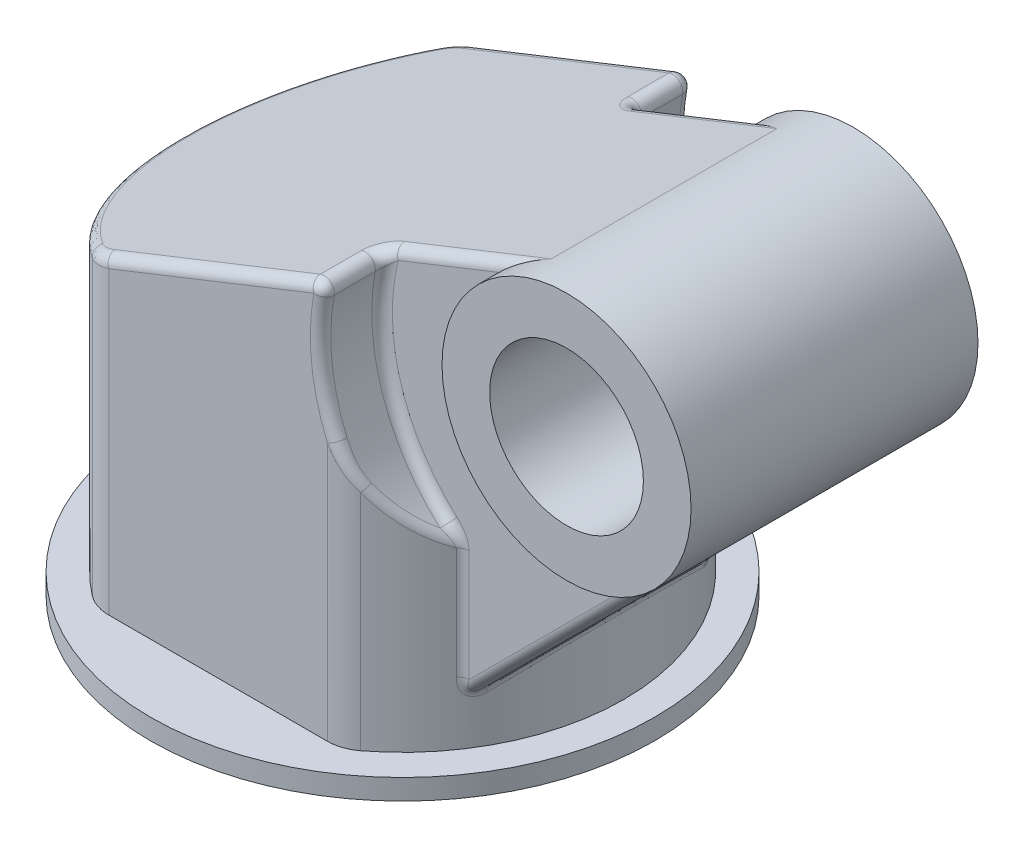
SolidWorks part; units mm, degrees
ref_plane "Front Plane" through (0, 0, 0) normal (0, 0, 1) x (1, 0, 0)
ref_plane "Top Plane" through (0, 0, 0) normal (0, 1, 0) x (1, 0, 0)
ref_plane "Right Plane" through (0, 0, 0) normal (1, 0, 0) x (0, 0, -1)
sketch "Sketch1" plane through (0, 0, 0) normal (0, 1, 0) x (1, 0, 0)
  circle A0 centre (0, 0) radius 123
  dimension "D1" = 246
extrude "Base" add sketch "Sketch1" along normal blind 10
sketch "Sketch2" plane through (0, 10, 0) normal (0, 1, 0) x (-1, 0, 0)
  line L0 (59.6992, -90) -> (-59.6992, -90)
  line L1 (0, 0) -> (84.2309, 0) construction
  line L2 (59.6992, 90) -> (-59.6992, 90)
  arc A1 (59.6992, -90) -> (59.6992, 90) centre (0, 0) ccw
  arc A2 (-59.6992, -90) -> (-59.6992, 90) centre (0, 0) cw
  circle A3 centre (0, 0) radius 123 construction
  dimension "D2" = 15
  dimension "D1" = 180
extrude "Boss-Extrude1" add sketch "Sketch2" along normal blind 196.649
sketch "Sketch6" plane through (0, 0, 0) normal (0, -1, 0) x (1, 0, 0)
  circle A0 centre (0, 0) radius 104.5
  dimension "D1" = 209
extrude "Boss-Extrude3" add sketch "Sketch6" along normal blind 3
sketch "Sketch3" plane through (0, 0, 0) normal (0, 0, 1) x (1, 0, 0)
  line L0 (-59.6992, 206.649) -> (59.6992, 206.649) construction
  line L1 (60, 206.649) -> (-108, 140)
  line L2 (123, 10) -> (-123, 10) construction
  line L3 (60, 206.649) -> (108, 100)
  line L5 (-108, 214.649) -> (-108, 140)
  line L6 (-108, 214.649) -> (108, 214.649)
  line L7 (108, 100) -> (108, 214.649)
  line L9 (-59.6992, 206.649) -> (-108, 206.649) construction
  line L10 (108, 10) -> (108, 206.649) construction
  line L11 (-108, 206.649) -> (-108, 10) construction
  point P0 (60, 206.649)
  dimension "D1" = 90
  dimension "D2" = 130
  dimension "D3" = 60
  dimension "D4" = 8
extrude "Cut-Extrude1" cut sketch "Sketch3" against normal through all and the other way through all
sketch "Sketch5" plane through (0, 0, 0) normal (0, 0, 1) x (1, 0, 0)
  line L0 (-104.5, -3) -> (104.5, -3) construction
  line L1 (78.4268, 19.5162) -> (4.1714, 184.5007)
  line L2 (4.1714, 184.5007) -> (127.5985, 233.4667)
  line L3 (78.4268, 19.5162) -> (192.9553, 134.0447)
  line L4 (-123, 0) -> (123, 0) construction
  line L5 (59.6992, 206.5297) -> (-59.6992, 159.1619) construction
  line L6 (83.8391, 153.6819) -> (60, 206.649) construction
  arc A0 (192.9553, 134.0447) -> (127.5985, 233.4667) centre (150, 177) ccw
  dimension "D1" = 180
  dimension "D2" = 150
  dimension "D4" = 45
  dimension "D6" = 60
extrude "Boss-Extrude2" add sketch "Sketch5" along normal mid plane 120
sketch "Sketch9" plane through (0, 0, 60) normal (0, 0, 1) x (1, 0, 0)
  circle A0 centre (150, 177) radius 100
  dimension "D1" = 200
extrude "Cut-Extrude2" cut sketch "Sketch9" along normal through all
sketch "Sketch7" plane through (0, 0, 0) normal (0, 0, 1) x (1, 0, 0)
  circle A0 centre (150, 177) radius 60.748
  arc A1 (192.9553, 134.0447) -> (127.5985, 233.4667) centre (150, 177) ccw construction
extrude "Boss-Extrude4" add sketch "Sketch7" along normal blind 70
mirror "Mirror1" about plane through (0, 0, 0) normal (0, 0, 1) of "Boss-Extrude4", "Cut-Extrude2"
fillet "Fillet1" radius 20 4 edges at (59.6992, 72.0188, -90) (59.6992, 72.0188, 90) (-59.6992, 84.5809, -90) (-59.6992, 84.5809, 90)
fillet "Fillet2" radius 5 22 edges at (141.3775, 82.4669, -60) (141.3775, 82.4669, 60) (90.6808, 218.8207, -60) (90.6808, 218.8207, 60) (89.7998, 64.0199, 60) (89.7998, 64.0199, -60) (108, 49.0894, 0) (0.217, 182.9319, -90) (-59.7252, 159.1516, -88.9497) (-108, 140, 0) (-59.7252, 159.1516, 88.9497) (0.217, 182.9319, 90) (53.7631, 204.1747, 75) (55.2283, 145.0889, 60) (73.0405, 113.1468, 79.5556) (63.069, 127.5733, 87.4681) (50.0034, 177.8225, 90) (55.2283, 145.0889, -60) (53.7631, 204.1747, -75) (50.0034, 177.8225, -90) (58.7002, 136.2036, -89.2653) (73.0405, 113.1468, -79.5556)
sketch "Sketch10" plane through (0, 0, 70) normal (0, 0, 1) x (1, 0, 0)
  circle A0 centre (150, 177) radius 37.5
  circle A1 centre (150, 177) radius 60.748 construction
  dimension "D1" = 75
extrude "Cut-Extrude3" cut sketch "Sketch10" against normal through all
